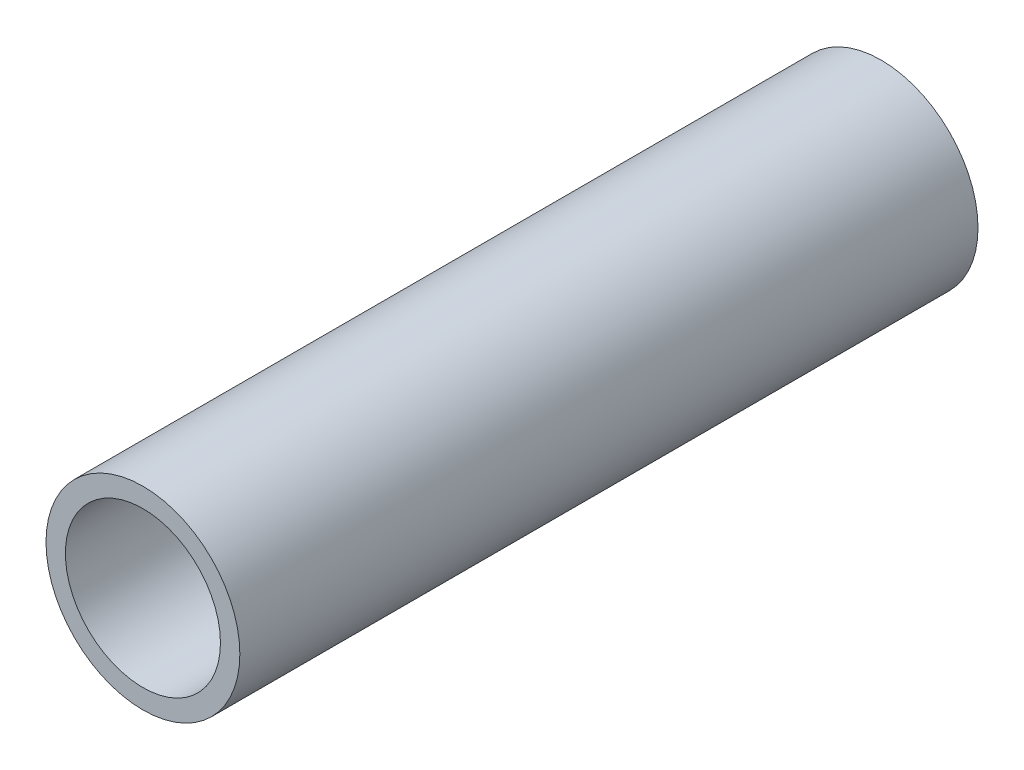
SolidWorks part; units mm, degrees
ref_plane "Front" through (0, 0, 0) normal (0, 0, 1) x (1, 0, 0)
ref_plane "Top" through (0, 0, 0) normal (0, 1, 0) x (1, 0, 0)
ref_plane "Right" through (0, 0, 0) normal (1, 0, 0) x (0, 0, -1)
sketch "Sketch1" plane through (0, 0, 0) normal (0, 0, 1) x (1, 0, 0)
  circle A0 centre (0, 0) radius 15.875
  circle A1 centre (0, 0) radius 12.7
  dimension "D1" = 31.75
  dimension "D2" = 25.4
extrude "Boss-Extrude1" add sketch "Sketch1" along normal mid plane 120.904
